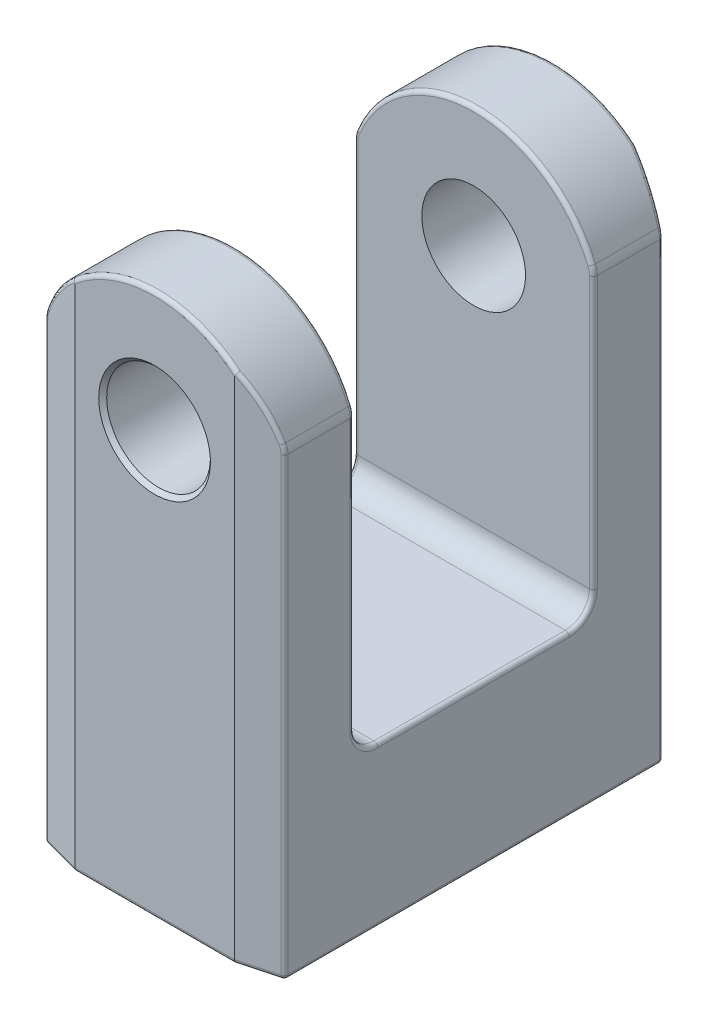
SolidWorks part; units mm, degrees
ref_plane "Plan1" through (0, 0, 0) normal (0, 0, 1) x (1, 0, 0)
ref_plane "Plan2" through (0, 0, 0) normal (0, 1, 0) x (1, 0, 0)
ref_plane "Plan3" through (0, 0, 0) normal (1, 0, 0) x (0, 0, -1)
sketch "Esquisse1" plane through (0, 0, 0) normal (0, 0, 1) x (1, 0, 0)
  line L1 (0, 0) -> (30, 0)
  line L2 (0, 0) -> (0, 68)
  line L3 (0, 68) -> (30, 68)
  line L4 (30, 0) -> (30, 68)
  dimension "D1" = 68
  dimension "D2" = 30
extrude "Base-Extrusion" add sketch "Esquisse1" along normal mid plane 50
chamfer "Chanfrein1" distance 5 angle 15 2 edges at (30, 34, 25) (0, 34, 25)
chamfer "Chanfrein2" distance 5 angle 15 2 edges at (30, 34, -25) (0, 34, -25)
sketch "Esquisse2" plane through (30, 0, 0) normal (1, 0, 0) x (0, 0, -1)
  line L0 (-23.6603, 68) -> (23.6603, 68) construction
  line L1 (-15, 68) -> (15, 68)
  line L2 (-15, 68) -> (-15, 20)
  line L3 (-15, 20) -> (15, 20)
  line L4 (15, 68) -> (15, 20)
  line L5 (-23.6603, 0) -> (23.6603, 0) construction
  point P6 (0, 68)
  dimension "D1" = 30
  dimension "D2" = 20
extrude "Enlèv. mat.-Extru.1" cut sketch "Esquisse2" against normal through all
sketch "Esquisse3" plane through (0, 0, 25) normal (0, 0, 1) x (1, 0, 0)
  line L0 (15, 0) -> (15, 68) construction
  line L1 (5, 0) -> (25, 0) construction
  line L2 (25, 68) -> (5, 68) construction
  line L3 (0, 57.5678) -> (0, 68)
  line L5 (0, 0) -> (0, 68) construction
  line L6 (30, 68) -> (30, 0) construction
  line L7 (30, 68) -> (30, 57.5678)
  circle A0 centre (15, 53) radius 6.5
  arc A1 (0, 57.5678) -> (30, 57.5678) centre (15, 52) cw
  arc A2 (0, 68) -> (30, 68) centre (15, 68) cw
  dimension "D1" = 13
  dimension "D2" = 53
  dimension "D3" = 1
extrude "Enlèv. mat.-Extru.2" cut sketch "Esquisse3" against normal through all
chamfer "Chanfrein3" distance 0.5 angle 45 2 edges at (21.5, 53, -25) (21.5, 53, 25)
fillet "Congé1" radius 3 8 edges at (15, 20, 15) (15, 20, -15) (30, 57.5678, 19.3301) (30, 57.5678, -19.3301) (2.0297, 61.3686, 24.2041) (27.9703, 61.3686, -24.2041) (0, 57.5678, 19.3301) (0, 57.5678, -19.3301)
fillet "Congé2" radius 0.5 38 edges at (15, 68, -15) (0, 40, -15) (30, 40, -15) (0.0583, 57.5883, -15) (29.9417, 57.5883, -15) (30, 20, 0) (0, 20, 0) (0, 40, 15) (15, 68, 15) (30, 40, 15) (0.0583, 57.5883, 15) (29.9417, 57.5883, 15) (30, 28.5, 23.6603) (29.9417, 57.5883, 23.6759) (2.2166, 61.6221, 24.2542) (15, 0, 25) (27.7834, 61.6221, -24.2542) (29.9417, 57.5883, -23.6759) (0.0583, 57.5883, 23.6759) (0, 28.5, -23.6603) (0.0583, 57.5883, -23.6759) (30, 20.8787, -14.1213) (0, 20.8787, -14.1213) (30, 20.8787, 14.1213) (0, 20.8787, 14.1213) (30, 0, 0) (0, 0, 0) (2.5, 0, 24.3301) (27.5, 0, 24.3301) (0, 28.5, 23.6603) (30, 28.5, -23.6603) (15, 0, -25) (2.5, 0, -24.3301) (27.5, 0, -24.3301) (15, 68, 25) (15, 68, -25) (27.7834, 61.6221, 24.2542) (2.2166, 61.6221, -24.2542)
